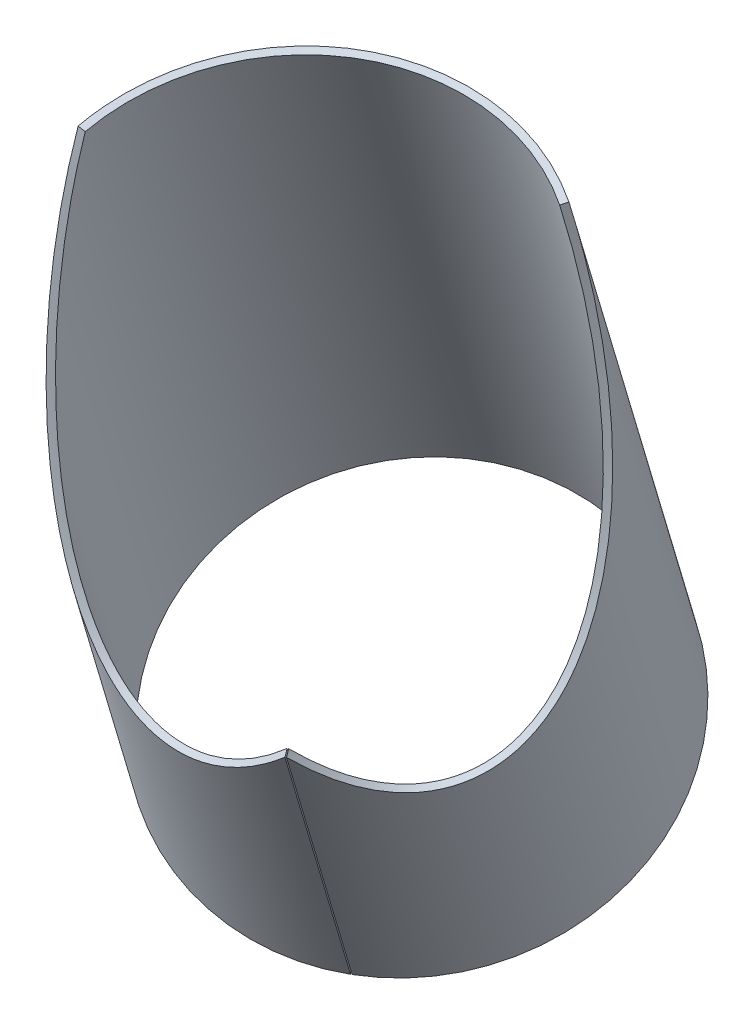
SolidWorks part; units mm, degrees
ref_plane "前视基准面" through (0, 0, 0) normal (0, 0, 1) x (1, 0, 0)
ref_plane "上视基准面" through (0, 0, 0) normal (0, 1, 0) x (1, 0, 0)
ref_plane "右视基准面" through (0, 0, 0) normal (1, 0, 0) x (0, 0, -1)
imported_body "基体零件-等径Y形四通管-1"
sheet metal parameters "钣金1" parameters "D1"=0.7366, "厚度"=6
bend "圆角折弯1" bend radius 174 bend angle 359.682 parameters "D5"=1
flatten bends "展开-折弯1"
sketch "尖角-草图1" plane through (-39.4765, -495.2491, -67.3753) normal (0.4306, -0.5, 0.7514) x (0.9025, 0.2386, -0.3585)
  line L0 (-567.883, 1.7742) -> (-481.6838, 300.7906) construction
  dimension "D1" = 0
process bends "加工-折弯1" parameters "D1"=0
sketch "平面-草图1" plane through (-39.4765, -495.2491, -67.3753) normal (0.4306, -0.5, 0.7514) x (0.9025, 0.2386, -0.3585)
